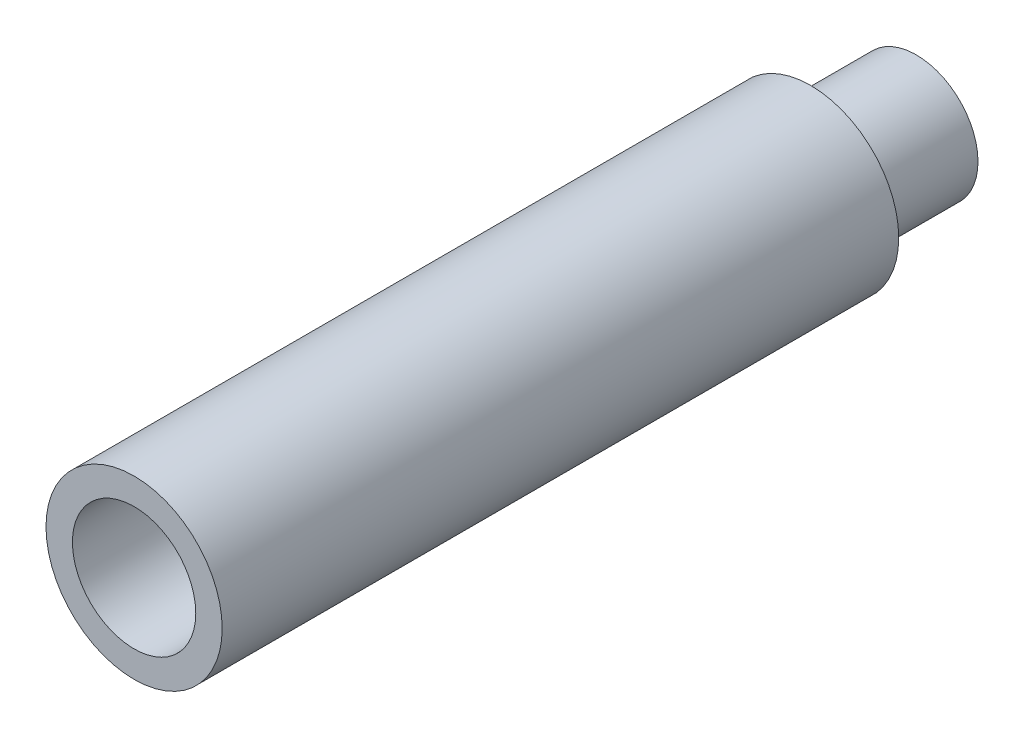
SolidWorks part; units mm, degrees
ref_plane "Front" through (0, 0, 0) normal (0, 0, 1) x (1, 0, 0)
ref_plane "Top" through (0, 0, 0) normal (0, 1, 0) x (1, 0, 0)
ref_plane "Side" through (0, 0, 0) normal (1, 0, 0) x (0, 0, -1)
sketch "Sketch1"
  dimension "D1" = 15.875
extrude "Base-Extrude" add sketch "Sketch1" against normal blind 60.96
sketch "Sketch2"
  dimension "D1" = 11.1125
extrude "Cut-Extrude1" cut sketch "Sketch2" against normal blind 25.4
sketch "Sketch3"
  dimension "D1" = 11.1125
extrude "Boss-Extrude1" add sketch "Sketch3" along normal blind 9.525
